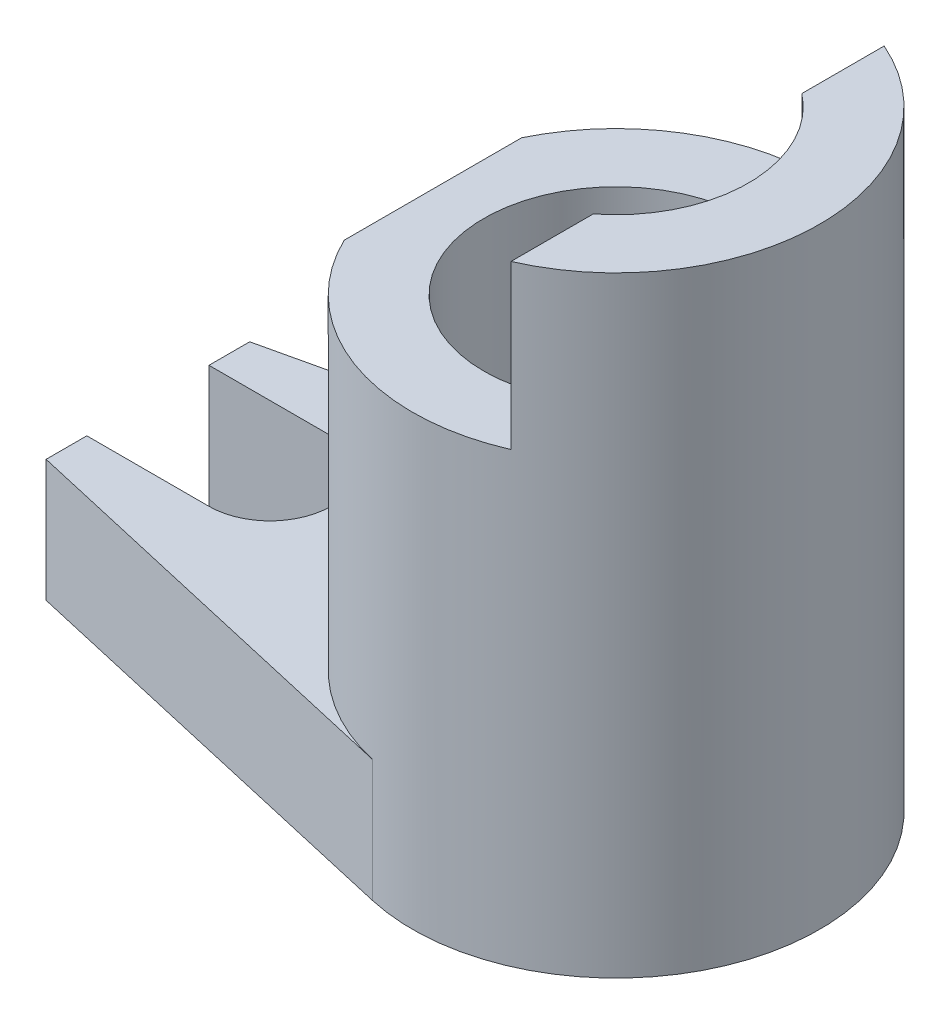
SolidWorks part; units mm, degrees
ref_plane "前视基准面" through (0, 0, 0) normal (0, 0, 1) x (1, 0, 0)
ref_plane "上视基准面" through (0, 0, 0) normal (0, 1, 0) x (1, 0, 0)
ref_plane "右视基准面" through (0, 0, 0) normal (1, 0, 0) x (0, 0, -1)
sketch "草图1" plane through (0, 0, 0) normal (0, 1, 0) x (1, 0, 0)
  line L0 (-11.1429, 48.7425) -> (-115, 25)
  line L1 (-115, 25) -> (-115, -25)
  line L2 (-115, -25) -> (-11.1429, -48.7425)
  line L3 (0, 0) -> (87.5132, 0) construction
  arc A0 (-11.1429, -48.7425) -> (-11.1429, 48.7425) centre (0, 0) ccw
  dimension "D1" = 100
  dimension "D2" = 115
  dimension "D3" = 50
extrude "拉伸1" add sketch "草图1" along normal blind 30
sketch "草图2" plane through (0, 30, 0) normal (0, 1, 0) x (1, 0, 0)
  line L0 (-115, 0) -> (-62.5287, 0) construction
  line L1 (-115, 25) -> (-115, -25) construction
  line L2 (-115, 0) -> (-85, 0) construction
  line L3 (-115, -15) -> (-85, -15)
  line L4 (-115, 15) -> (-85, 15)
  arc A0 (-115, -15) -> (-115, 15) centre (-115, 0) cw
  arc A1 (-85, -15) -> (-85, 15) centre (-85, 0) ccw
  dimension "D3" = 30
  dimension "D1" = 15
  dimension "D2" = 15
extrude "切除-拉伸1" cut sketch "草图2" against normal through all
sketch "草图3" plane through (0, 30, 0) normal (0, 1, 0) x (1, 0, 0)
  circle A0 centre (0, 0) radius 50
  circle A1 centre (0, 0) radius 32.5
  dimension "D1" = 65
extrude "拉伸2" add sketch "草图3" along normal blind 120
sketch "草图4" plane through (0, 150, 0) normal (0, 1, 0) x (1, 0, 0)
  line L1 (-70.0862, 63.7452) -> (20, 63.7452)
  line L2 (-70.0862, 63.7452) -> (-70.0862, -62.4282)
  line L3 (-70.0862, -62.4282) -> (20, -62.4282)
  line L4 (20, 63.7452) -> (20, -62.4282)
  dimension "D1" = 20
extrude "切除-拉伸2" cut sketch "草图4" against normal blind 40
sketch "草图5" plane through (0, 110, 0) normal (0, 1, 0) x (1, 0, 0)
  line L1 (-62.6485, 25.024) -> (-45, 25.024)
  line L2 (-62.6485, 25.024) -> (-62.6485, -29.2385)
  line L3 (-62.6485, -29.2385) -> (-45, -29.2385)
  line L4 (-45, 25.024) -> (-45, -29.2385)
  dimension "D1" = 45
extrude "切除-拉伸3" cut sketch "草图5" against normal blind 40
